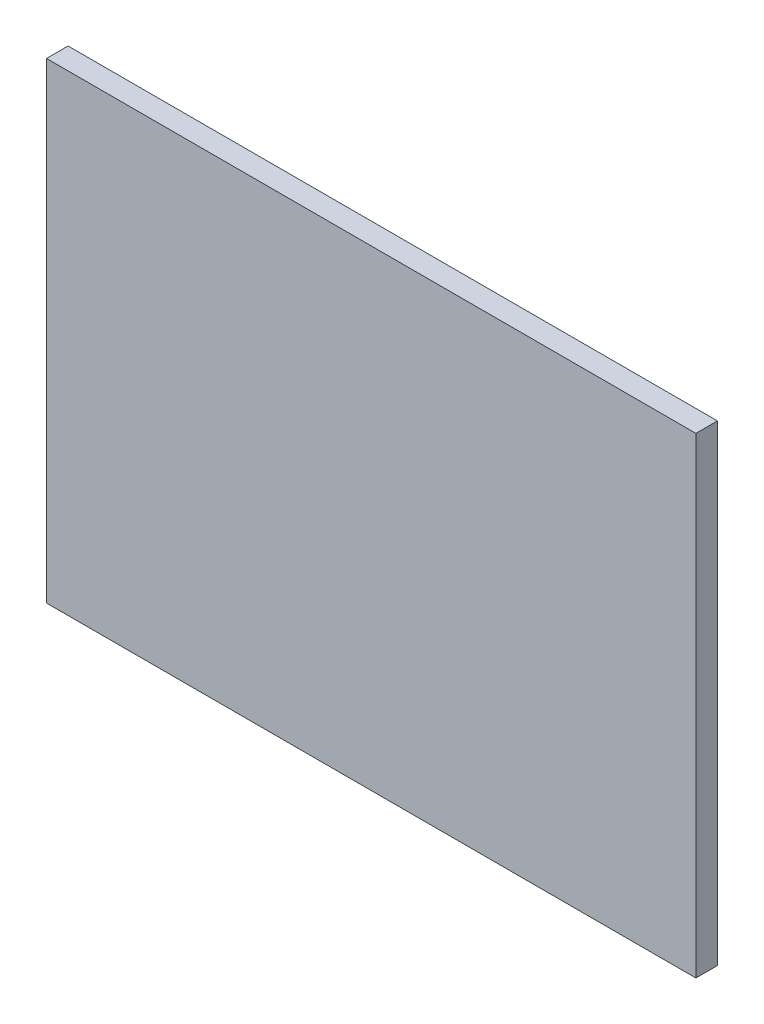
SolidWorks part; units mm, degrees
ref_plane "Plan de face" through (0, 0, 0) normal (0, 0, 1) x (1, 0, 0)
ref_plane "Plan de dessus" through (0, 0, 0) normal (0, 1, 0) x (1, 0, 0)
ref_plane "Plan de droite" through (0, 0, 0) normal (1, 0, 0) x (0, 0, -1)
sketch "Esquisse1" plane through (0, 0, 0) normal (0, 0, 1) x (1, 0, 0)
  line L1 (-153.5, 111.5) -> (153.5, 111.5)
  line L2 (-153.5, 111.5) -> (-153.5, -111.5)
  line L3 (-153.5, -111.5) -> (153.5, -111.5)
  line L4 (153.5, 111.5) -> (153.5, -111.5)
  line L5 (-153.5, 111.5) -> (153.5, -111.5) construction
  line L6 (-153.5, -111.5) -> (153.5, 111.5) construction
  point P0 (0, 0)
  dimension "D1" = 307
  dimension "D2" = 223
extrude "Boss.-Extru.1" add sketch "Esquisse1" along normal mid plane 10.2
